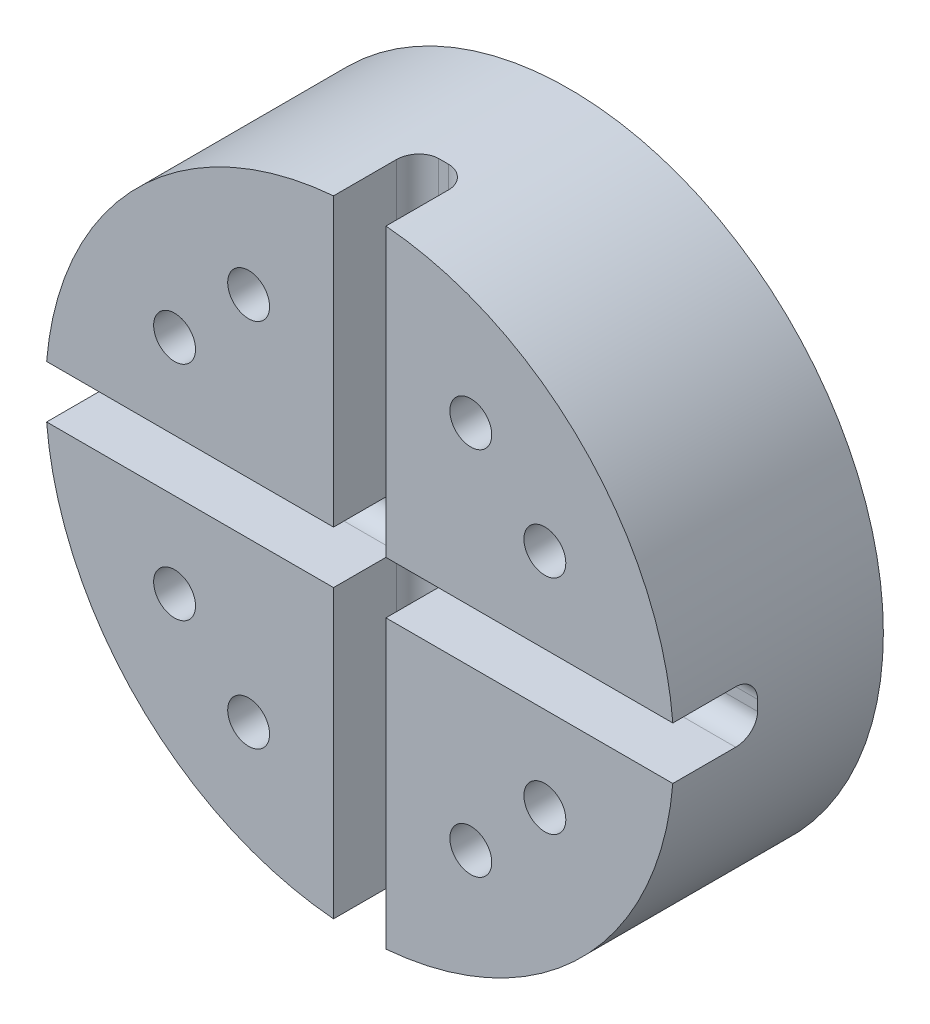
SolidWorks part; units mm, degrees
ref_plane "Front Plane" through (0, 0, 0) normal (0, 0, 1) x (1, 0, 0)
ref_plane "Top Plane" through (0, 0, 0) normal (0, 1, 0) x (1, 0, 0)
ref_plane "Right Plane" through (0, 0, 0) normal (1, 0, 0) x (0, 0, -1)
sketch "Sketch2" plane through (0, 0, 0) normal (0, 0, 1) x (1, 0, 0)
  circle A0 centre (0, 0) radius 15
  dimension "D1" = 30
extrude "Boss-Extrude1" add sketch "Sketch2" along normal blind 10
sketch "Sketch3" plane through (0, 0, 10) normal (0, 0, 1) x (1, 0, 0)
  line L5 (-1.25, 1.25) -> (-1.25, 15.296)
  line L6 (1.25, 1.25) -> (1.25, 15.296)
  line L7 (-1.25, 15.296) -> (1.25, 15.296)
  line L9 (1.25, 1.25) -> (15.6747, 1.25)
  line L10 (1.25, -1.25) -> (15.6747, -1.25)
  line L11 (15.6747, 1.25) -> (15.6747, -1.25)
  line L13 (1.25, -1.25) -> (1.25, -15.6292)
  line L14 (-1.25, -1.25) -> (-1.25, -15.6292)
  line L15 (1.25, -15.6292) -> (-1.25, -15.6292)
  line L17 (-1.25, 1.25) -> (-15.4105, 1.25)
  line L18 (-1.25, -1.25) -> (-15.4105, -1.25)
  line L19 (-15.4105, 1.25) -> (-15.4105, -1.25)
extrude "Cut-Extrude1" cut sketch "Sketch3" against normal blind 4
fillet "Fillet1" radius 1 8 edges at (-1.25, -8.0989, 6) (1.25, -8.0989, 6) (8.0989, -1.25, 6) (8.0989, 1.25, 6) (1.25, 8.0989, 6) (-1.25, 8.0989, 6) (-8.0989, -1.25, 6) (-8.0989, 1.25, 6)
sketch "Sketch4" plane through (0, 0, 10) normal (0, 0, 1) x (1, 0, 0)
  line L0 (0, 0) -> (-10.6066, 10.6066) construction
  line L1 (-5.3033, 5.3033) -> (-5.3033, 8.8388) construction
  line L2 (-5.3033, 5.3033) -> (-8.8388, 5.3033) construction
  line L6 (-8.8388, 5.3033) -> (-5.3033, 8.8388) construction
  arc A3 (-1.25, 14.9478) -> (-14.9478, 1.25) centre (0, 0) ccw construction
  circle A4 centre (-8.8388, 5.3033) radius 1
  circle A5 centre (-5.3033, 8.8388) radius 1
  dimension "D2" = 2
  dimension "D1" = 5
extrude "Cut-Extrude2" cut sketch "Sketch4" against normal up to surface (10 mm away) contours A5 | A4
pattern_circular "CirPattern1" count 4 every 90 about axis through (0, 0, 0) along (0, 0, 1) of "Cut-Extrude2"
